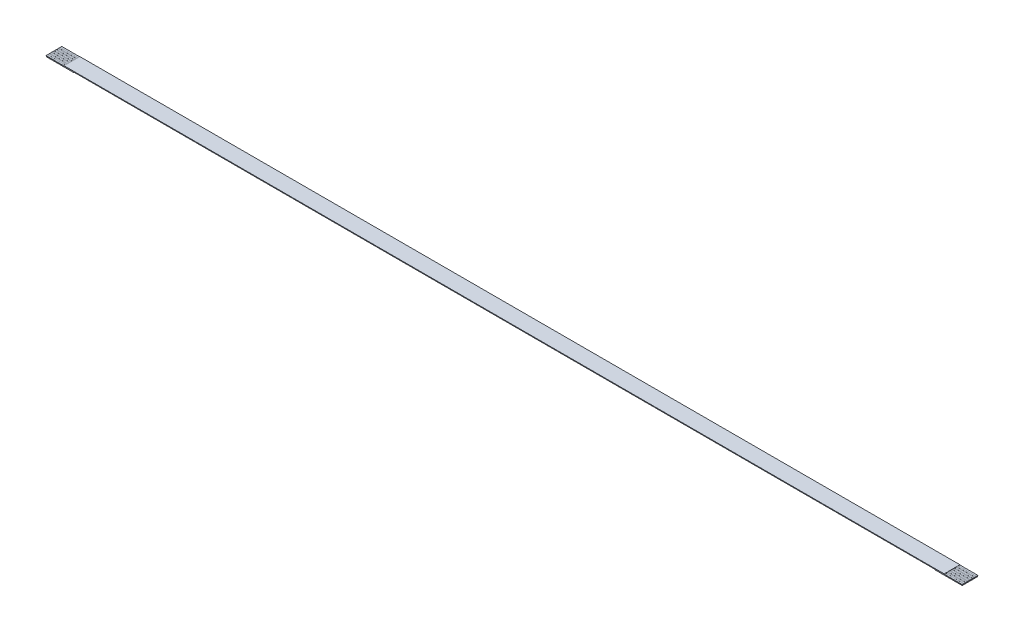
SolidWorks part; units mm, degrees
ref_plane "Front Plane" through (0, 0, 0) normal (0, 0, 1) x (1, 0, 0)
ref_plane "Top Plane" through (0, 0, 0) normal (0, 1, 0) x (1, 0, 0)
ref_plane "Right Plane" through (0, 0, 0) normal (1, 0, 0) x (0, 0, -1)
sketch "Sketch1" plane through (0, 0, 0) normal (0, 1, 0) x (1, 0, 0)
  line L1 (0, 0) -> (203, 0)
  line L2 (0, 0) -> (0, 3.5)
  line L3 (0, 3.5) -> (203, 3.5)
  line L4 (203, 0) -> (203, 3.5)
  dimension "D1" = 203
  dimension "D2" = 3.5
sheet metal parameters "Sheet-Metal1" thickness 0.15 parameters "D1"=0.7366
base flange "Base-Flange1" sketch "Sketch1" thickness 0.15 reverse thickness direction no parameters "D1"=0.7366
sketch "Sketch14" plane through (0, 0, 0) normal (0, 1, 0) x (1, 0, 0)
  line L0 (0, 3.5) -> (0, 0) construction
  line L1 (-4, 7.5) -> (4, 7.5)
  line L2 (-4, 7.5) -> (-4, -4)
  line L3 (-4, -4) -> (4, -4)
  line L4 (4, 7.5) -> (4, -4)
  line L5 (203, 0) -> (203, 3.5) construction
  line L6 (199, 7.5) -> (207, 7.5)
  line L7 (199, 7.5) -> (199, -4)
  line L8 (199, -4) -> (207, -4)
  line L9 (207, 7.5) -> (207, -4)
  line L10 (203, 3.5) -> (0, 3.5) construction
  line L11 (0, 0) -> (203, 0) construction
  dimension "D1" = 4
  dimension "D2" = 4
  dimension "D3" = 4
  dimension "D4" = 4
  dimension "D5" = 8
  dimension "D6" = 4
  dimension "D7" = 4
  dimension "D8" = 8
extrude "Cut-Extrude1" cut sketch "Sketch14" against normal blind 0.05
sketch "Sketch4" plane through (0, -0.05, 0) normal (0, 1, 0) x (1, 0, 0)
  line L1 (0.01, 5.15) -> (3.99, 5.15) construction
  line L2 (0.01, 5.15) -> (0.01, 4.85) construction
  line L3 (0.01, 4.85) -> (3.99, 4.85) construction
  line L4 (3.99, 5.15) -> (3.99, 4.85) construction
  line L5 (0, 0) -> (0, 3.5) construction
  line L6 (0.01, 4.65) -> (3.99, 4.65) construction
  line L7 (0.01, 4.65) -> (0.01, 4.35) construction
  line L8 (0.01, 4.35) -> (3.99, 4.35) construction
  line L9 (3.99, 4.65) -> (3.99, 4.35) construction
  line L10 (0.01, 4.15) -> (3.99, 4.15) construction
  line L11 (0.01, 4.15) -> (0.01, 3.85) construction
  line L12 (0.01, 3.85) -> (3.99, 3.85) construction
  line L13 (3.99, 4.15) -> (3.99, 3.85) construction
  line L14 (0.01, 3.65) -> (3.99, 3.65) construction
  line L15 (0.01, 3.65) -> (0.01, 3.35) construction
  line L16 (0.01, 3.35) -> (3.99, 3.35) construction
  line L17 (3.99, 3.65) -> (3.99, 3.35) construction
  line L18 (0.01, 3.15) -> (3.99, 3.15)
  line L19 (0.01, 3.15) -> (0.01, 2.85)
  line L20 (0.01, 2.85) -> (3.99, 2.85)
  line L21 (3.99, 3.15) -> (3.99, 2.85)
  line L22 (0.01, 2.65) -> (3.99, 2.65)
  line L23 (0.01, 2.65) -> (0.01, 2.35)
  line L24 (0.01, 2.35) -> (3.99, 2.35)
  line L25 (3.99, 2.65) -> (3.99, 2.35)
  line L26 (0.01, 2.15) -> (3.99, 2.15)
  line L27 (0.01, 2.15) -> (0.01, 1.85)
  line L28 (0.01, 1.85) -> (3.99, 1.85)
  line L29 (3.99, 2.15) -> (3.99, 1.85)
  line L30 (0.01, 1.65) -> (3.99, 1.65)
  line L31 (0.01, 1.65) -> (0.01, 1.35)
  line L32 (0.01, 1.35) -> (3.99, 1.35)
  line L33 (3.99, 1.65) -> (3.99, 1.35)
  line L34 (0.01, 1.15) -> (3.99, 1.15)
  line L35 (0.01, 1.15) -> (0.01, 0.85)
  line L36 (0.01, 0.85) -> (3.99, 0.85)
  line L37 (3.99, 1.15) -> (3.99, 0.85)
  line L38 (0.01, 0.65) -> (3.99, 0.65)
  line L39 (0.01, 0.65) -> (0.01, 0.35)
  line L40 (0.01, 0.35) -> (3.99, 0.35)
  line L41 (3.99, 0.65) -> (3.99, 0.35)
  line L42 (199.01, 5.15) -> (202.99, 5.15) construction
  line L43 (199.01, 5.15) -> (199.01, 4.85) construction
  line L44 (199.01, 4.85) -> (202.99, 4.85) construction
  line L45 (202.99, 5.15) -> (202.99, 4.85) construction
  line L46 (199.01, 4.65) -> (202.99, 4.65) construction
  line L47 (199.01, 4.65) -> (199.01, 4.35) construction
  line L48 (199.01, 4.35) -> (202.99, 4.35) construction
  line L49 (202.99, 4.65) -> (202.99, 4.35) construction
  line L50 (199.01, 4.15) -> (202.99, 4.15) construction
  line L51 (199.01, 4.15) -> (199.01, 3.85) construction
  line L52 (199.01, 3.85) -> (202.99, 3.85) construction
  line L53 (202.99, 4.15) -> (202.99, 3.85) construction
  line L54 (199.01, 3.65) -> (202.99, 3.65) construction
  line L55 (199.01, 3.65) -> (199.01, 3.35) construction
  line L56 (199.01, 3.35) -> (202.99, 3.35) construction
  line L57 (202.99, 3.65) -> (202.99, 3.35) construction
  line L58 (199.01, 3.15) -> (202.99, 3.15)
  line L59 (199.01, 3.15) -> (199.01, 2.85)
  line L60 (199.01, 2.85) -> (202.99, 2.85)
  line L61 (202.99, 3.15) -> (202.99, 2.85)
  line L62 (199.01, 2.65) -> (202.99, 2.65)
  line L63 (199.01, 2.65) -> (199.01, 2.35)
  line L64 (199.01, 2.35) -> (202.99, 2.35)
  line L65 (202.99, 2.65) -> (202.99, 2.35)
  line L66 (199.01, 2.15) -> (202.99, 2.15)
  line L67 (199.01, 2.15) -> (199.01, 1.85)
  line L68 (199.01, 1.85) -> (202.99, 1.85)
  line L69 (202.99, 2.15) -> (202.99, 1.85)
  line L70 (199.01, 1.65) -> (202.99, 1.65)
  line L71 (199.01, 1.65) -> (199.01, 1.35)
  line L72 (199.01, 1.35) -> (202.99, 1.35)
  line L73 (202.99, 1.65) -> (202.99, 1.35)
  line L74 (199.01, 1.15) -> (202.99, 1.15)
  line L75 (199.01, 1.15) -> (199.01, 0.85)
  line L76 (199.01, 0.85) -> (202.99, 0.85)
  line L77 (202.99, 1.15) -> (202.99, 0.85)
  line L78 (199.01, 0.65) -> (202.99, 0.65)
  line L79 (199.01, 0.65) -> (199.01, 0.35)
  line L80 (199.01, 0.35) -> (202.99, 0.35)
  line L81 (202.99, 0.65) -> (202.99, 0.35)
  line L82 (4, 0) -> (4, 3.5) construction
  line L83 (199, 3.5) -> (199, 0) construction
  line L84 (0.01, 0.5) -> (1.1774, 0.5) construction
  line L85 (0.01, 3) -> (0.4984, 3) construction
  line L86 (0, 3.5) -> (4, 3.5) construction
  line L87 (4, 0) -> (0, 0) construction
  dimension "D2" = 0.3
  dimension "D5" = 0.5
  dimension "D6" = 0.01
  dimension "D7" = 0.01
  dimension "D8" = 0.01
  dimension "D9" = 0.5
  dimension "D10" = 0.5
  dimension "D11" = 0.2
  dimension "D3" = 10
  dimension "D4" = 2
extrude "Boss-Extrude2" add sketch "Sketch4" along normal blind 0.01
sketch "Sketch5" plane through (0, -0.15, 0) normal (0, -1, 0) x (1, 0, 0)
  line L0 (0, 0) -> (203, 0) construction
  line L1 (0.05, -0.05) -> (6.05, -0.05)
  line L2 (0.05, -0.05) -> (0.05, -3.45)
  line L3 (0.05, -3.45) -> (6.05, -3.45)
  line L4 (6.05, -0.05) -> (6.05, -3.45)
  line L5 (0, -3.5) -> (0, 0) construction
  line L6 (202.95, -0.05) -> (196.95, -0.05)
  line L7 (202.95, -0.05) -> (202.95, -3.45)
  line L8 (202.95, -3.45) -> (196.95, -3.45)
  line L9 (196.95, -0.05) -> (196.95, -3.45)
  line L10 (203, -3.5) -> (0, -3.5) construction
  line L11 (203, 0) -> (203, -3.5) construction
  dimension "D1" = 6
  dimension "D2" = 6
  dimension "D3" = 0.05
  dimension "D4" = 0.05
  dimension "D5" = 0.05
  dimension "D6" = 0.05
extrude "Boss-Extrude3" add sketch "Sketch5" along normal blind 0.15
flat pattern "Flat-Pattern1"
sketch "Bend-Lines1" plane through (0, 0, 0) normal (0, 1, 0) x (-1, 0, 0)
